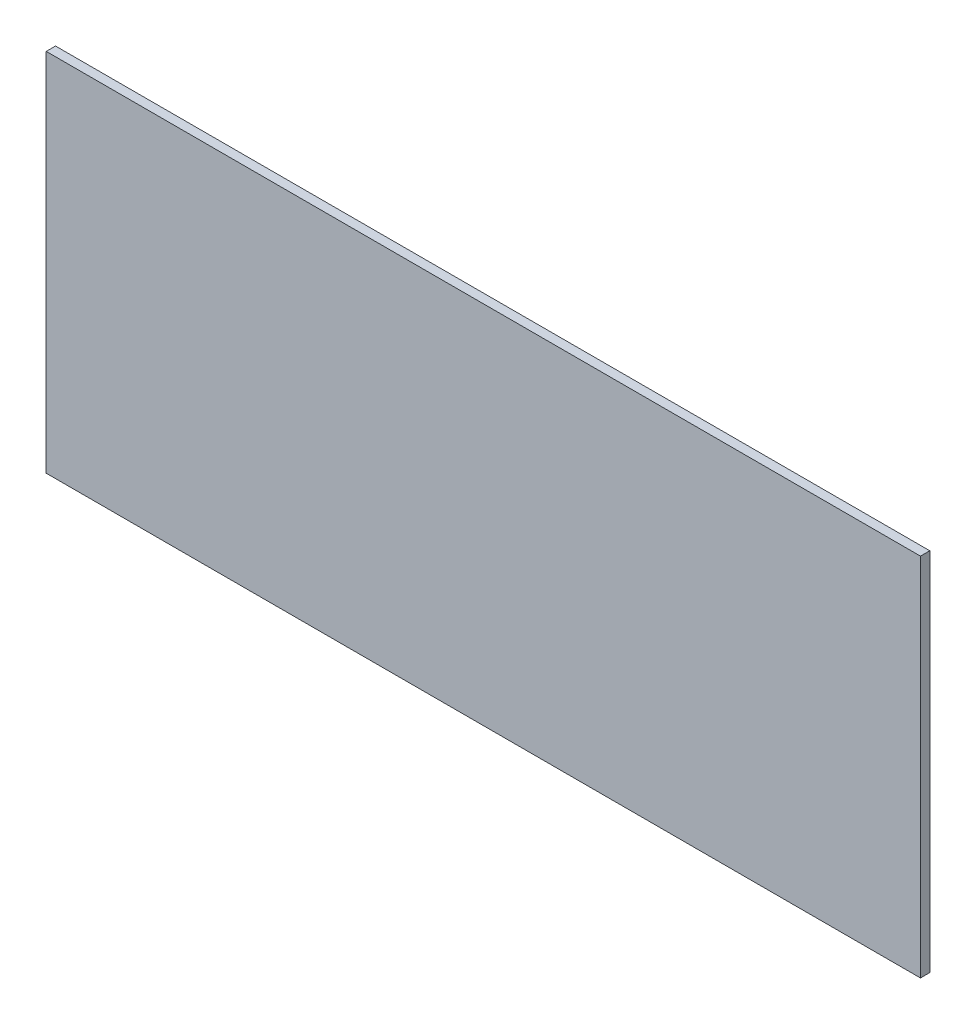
SolidWorks part; units mm, degrees
ref_plane "Front Plane" through (0, 0, 0) normal (0, 0, 1) x (1, 0, 0)
ref_plane "Top Plane" through (0, 0, 0) normal (0, 1, 0) x (1, 0, 0)
ref_plane "Right Plane" through (0, 0, 0) normal (1, 0, 0) x (0, 0, -1)
sketch "Sketch1" plane through (0, 0, 702.6158) normal (0, 0, -1) x (-1, 0, 0)
  line L1 (610.7154, 277.5506) -> (909.0279, 277.5506)
  line L2 (610.7154, 277.5506) -> (610.7154, 402.2121)
  line L3 (610.7154, 402.2121) -> (909.0279, 402.2121)
  line L4 (909.0279, 277.5506) -> (909.0279, 402.2121)
extrude "Boss-Extrude1" add sketch "Sketch1" against normal blind 3.175
